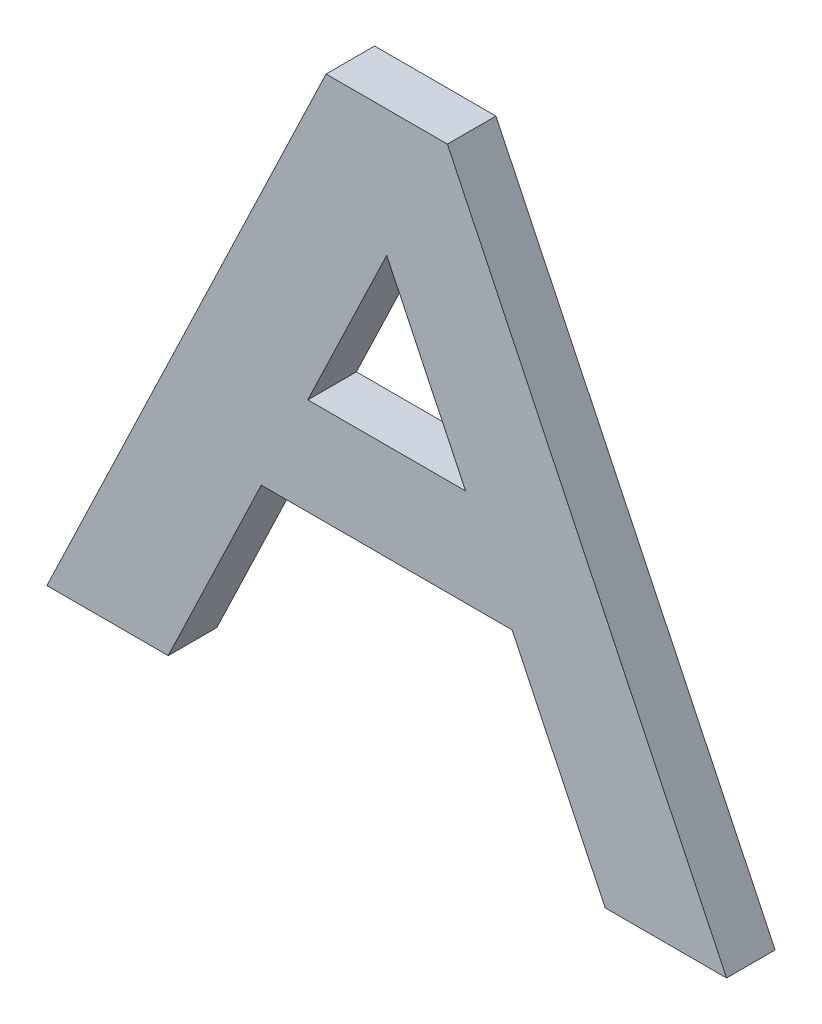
SolidWorks part; units mm, degrees
ref_plane "Front Plane" through (0, 0, 0) normal (0, 0, 1) x (1, 0, 0)
ref_plane "Top Plane" through (0, 0, 0) normal (0, 1, 0) x (1, 0, 0)
ref_plane "Right Plane" through (0, 0, 0) normal (1, 0, 0) x (0, 0, -1)
sketch "Sketch1" plane through (0, 0, 0) normal (0, 0, 1) x (1, 0, 0)
  line L0 (0, 0) -> (0, 76.2) construction
  line L1 (-7.9375, 76.2) -> (7.9375, 76.2)
  line L2 (7.9375, 76.2) -> (44.45, 0)
  line L3 (-7.9375, 76.2) -> (-44.45, 0)
  line L4 (44.45, 0) -> (28.575, 0)
  line L5 (-44.45, 0) -> (-28.575, 0)
  line L6 (28.575, 0) -> (16.4042, 25.4)
  line L7 (-28.575, 0) -> (-16.4042, 25.4)
  line L8 (16.4042, 25.4) -> (-16.4042, 25.4)
  line L9 (0, 59.6348) -> (10.3187, 38.1)
  line L10 (0, 59.6348) -> (-10.3187, 38.1)
  line L11 (10.3187, 38.1) -> (-10.3187, 38.1)
  point P6 (0, 76.2)
  point P12 (0, 25.4)
  point P16 (0, 38.1)
  dimension "D1" = 88.9
  dimension "D2" = 15.875
  dimension "D3" = 25.4
  dimension "D4" = 15.875
  dimension "D5" = 76.2
  dimension "D6" = 12.7
extrude "Extrude1" add sketch "Sketch1" along normal blind 6.35
